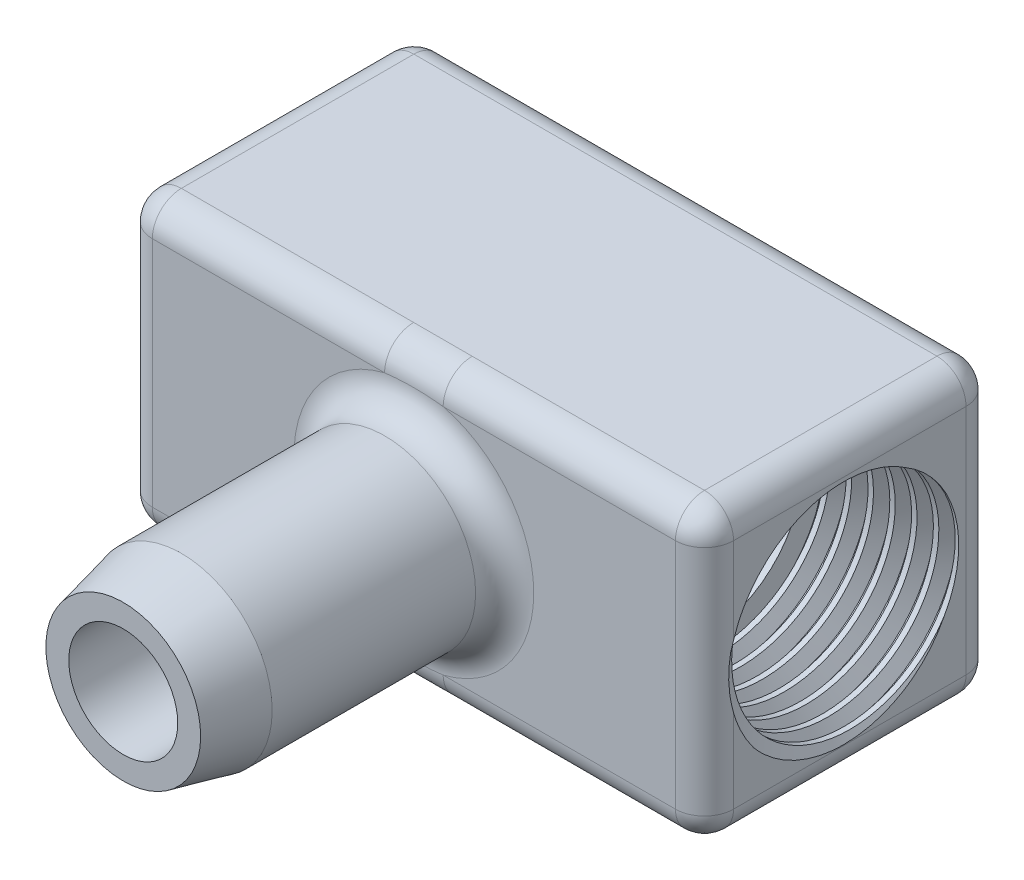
SolidWorks part; units mm, degrees
ref_plane "Plan de face" through (0, 0, 0) normal (0, 0, 1) x (1, 0, 0)
ref_plane "Plan de dessus" through (0, 0, 0) normal (0, 1, 0) x (1, 0, 0)
ref_plane "Plan de droite" through (0, 0, 0) normal (1, 0, 0) x (0, 0, -1)
sketch "Esquisse1" plane through (0, 0, 0) normal (0, 0, 1) x (1, 0, 0)
  line L1 (-20, 10) -> (20, 10)
  line L2 (-20, 10) -> (-20, -10)
  line L3 (-20, -10) -> (20, -10)
  line L4 (20, 10) -> (20, -10)
  point P4 (0, 10)
  point P6 (-20, 0)
  dimension "D1" = 20
  dimension "D2" = 40
extrude "Boss.-Extru.1" add sketch "Esquisse1" along normal blind 20
sketch "Esquisse2" plane through (0, 0, 20) normal (0, 0, 1) x (1, 0, 0)
  circle A0 centre (0, 0) radius 6.25
  circle A1 centre (0, 0) radius 3.75
  dimension "D1" = 12.5
  dimension "D2" = 7.5
extrude "Boss.-Extru.2" add sketch "Esquisse2" along normal blind 20
sketch "Esquisse3" plane through (20, 0, 0) normal (1, 0, 0) x (0, 0, -1)
  line L0 (-20, 10) -> (0, 10) construction
  circle A0 centre (-10, 0) radius 7.5
  point P2 (0, 0)
  point P6 (-10, 10)
  dimension "D1" = 15
extrude "Enlèv. mat.-Extru.1" cut sketch "Esquisse3" against normal blind 10
thread "Filetage1" pitch 1.5 start angle 0, offset 2, length 0, pitch 1.5, diameter 15
ref_plane "Plan2" through (22, 0, 17.5) normal (0, -1, 0) x (0, 0, 1)
sketch "Profil de filetage2" plane through (22, 0, 17.5) normal (0, -1, 0) x (0, 0, 1)
  line L0 (0, 0) -> (0, 1.5) construction
  line L1 (0, 0) -> (0.8119, 0.4687)
  line L2 (0.8119, 0.4687) -> (0.8119, 0.6562)
  line L3 (0.8119, 0.6562) -> (0, 1.125)
  line L4 (0.8119, 0.5625) -> (0, 0.5625) construction
  line L11 (0, 0) -> (0, 1.125)
  point P2 (0, 0)
  dimension "Pitch" = 1.5
  dimension "Profile_Angle" = 60
  dimension "Profile_Land" = 0.1875
  dimension "Profile_Height" = 0.8119
sketch "Esquisse17" plane through (10, 0, 0) normal (1, 0, 0) x (0, 0, -1)
  line L0 (-20, 10) -> (0, 10) construction
  circle A0 centre (-10, 0) radius 6.75
  point P2 (0, 0)
  point P6 (-10, 10)
  dimension "D1" = 13.5
extrude "Enlèv. mat.-Extru.2" cut sketch "Esquisse17" against normal blind 8
mirror "Symétrie2" about plane through (0, 0, 0) normal (1, 0, 0) of "Enlèv. mat.-Extru.2", "Enlèv. mat.-Extru.1"
thread "Filetage2" pitch 1.5 start angle 0, offset 2, length 0, pitch 1.5, diameter 15
ref_plane "Plan3" through (-22, 0, 2.5) normal (0, -1, 0) x (0, 0, -1)
sketch "Profil de filetage3" plane through (-22, 0, 2.5) normal (0, -1, 0) x (0, 0, -1)
  line L0 (0, 0) -> (0, 1.5) construction
  line L1 (0, 0) -> (0.8119, 0.4687)
  line L2 (0.8119, 0.4687) -> (0.8119, 0.6562)
  line L3 (0.8119, 0.6562) -> (0, 1.125)
  line L4 (0.8119, 0.5625) -> (0, 0.5625) construction
  line L11 (0, 0) -> (0, 1.125)
  point P2 (0, 0)
  dimension "Pitch" = 1.5
  dimension "Profile_Angle" = 60
  dimension "Profile_Land" = 0.1875
  dimension "Profile_Height" = 0.8119
sketch "Esquisse20" plane through (0, 0, 20) normal (0, 0, 1) x (1, 0, 0)
  circle A0 centre (0, 0) radius 3.75
  circle A1 centre (0, 0) radius 3.75 construction
extrude "Enlèv. mat.-Extru.3" cut sketch "Esquisse20" against normal blind 13
fillet "Congé6" radius 2 2 edges at (3.7485, 0.1064, 16.7492) (-3.7485, 0.1064, 16.7492)
fillet "Congé1" radius 2 4 edges at (-2, -3.1721, 12.1368) (-2, 3.1721, 12.1368) (2, 3.1721, 12.1368) (2, -3.1721, 12.1368)
fillet "Congé2" radius 3 2 edges
fillet "Congé3" radius 3 2 edges
fillet "Congé5" radius 2 10 edges
fillet "Congé7" radius 2 5 edges at (-3.0568, -6.4176, 8.8855) (-3.0568, 6.4176, 8.8855) (3.0568, 6.4176, 8.8855) (3.0568, -6.4176, 8.8855) (-2, -2.8457, 7.2626)
fillet "Congé8" radius 2 1 edges at (6.25, 0, 20)
chamfer "Chanfrein1" distance 4 angle 13 1 edges at (6.25, 0, 40)
fillet "Congé9" radius 2 12 edges at (20, 0, 0) (-20, 0, 0) (20, 0, 20) (-20, 0, 20) (-20, -10, 10) (0, -10, 20) (20, -10, 10) (0, -10, 0) (20, 10, 10) (0, 10, 20) (-20, 10, 10) (0, 10, 0)
